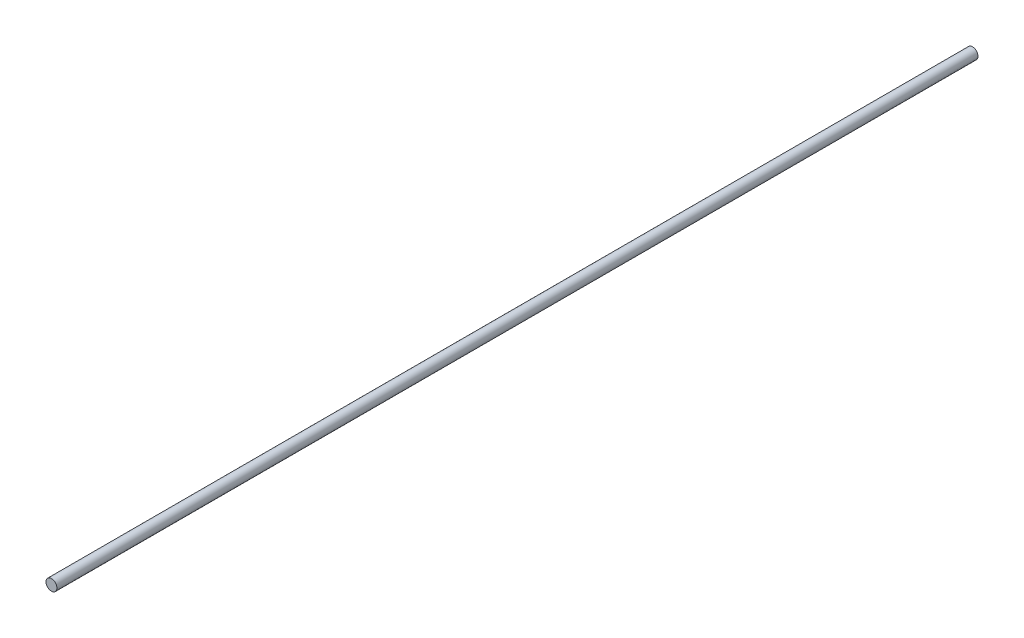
SolidWorks part; units mm, degrees
ref_plane "Front Plane" through (0, 0, 0) normal (0, 0, 1) x (1, 0, 0)
ref_plane "Top Plane" through (0, 0, 0) normal (0, 1, 0) x (1, 0, 0)
ref_plane "Right Plane" through (0, 0, 0) normal (1, 0, 0) x (0, 0, -1)
sketch "Sketch1" plane through (0, 0, 0) normal (0, 0, 1) x (1, 0, 0)
  circle A0 centre (0, 0) radius 30
  dimension "D1" = 60
extrude "Boss-Extrude1" add sketch "Sketch1" against normal blind 5050
